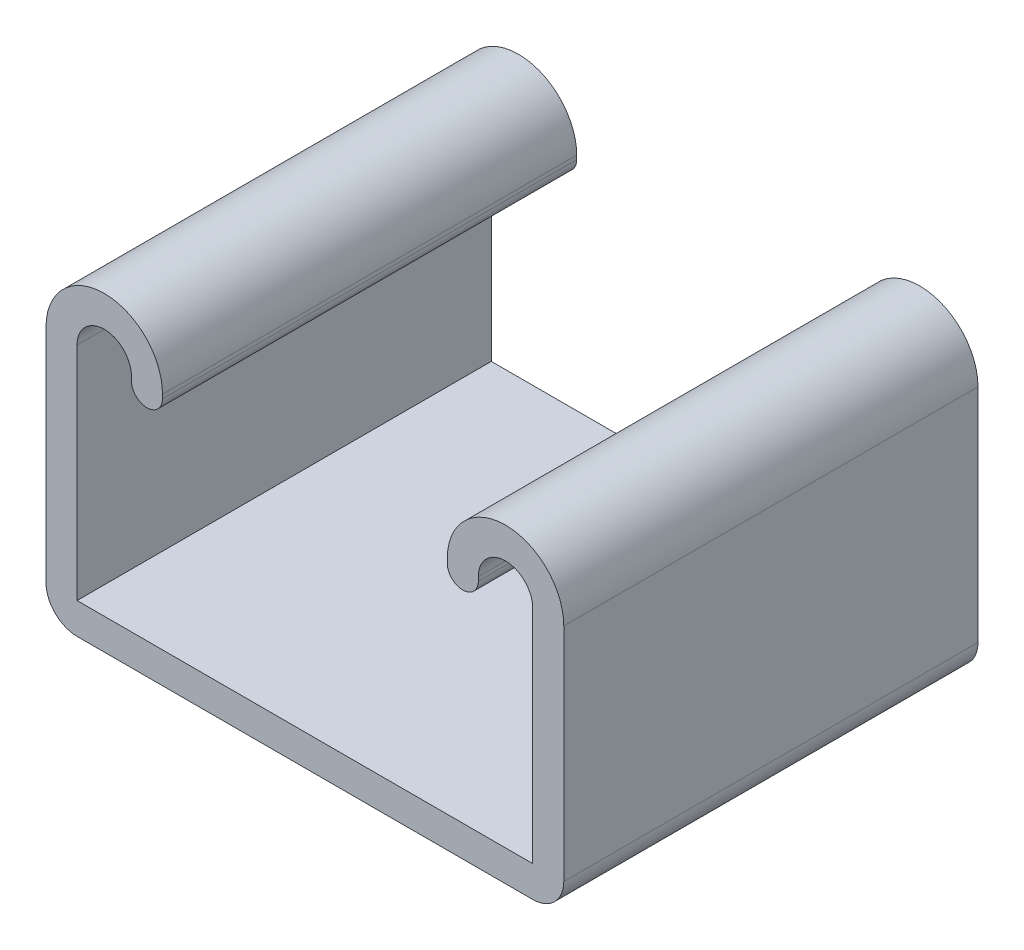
SolidWorks part; units mm, degrees
ref_plane "Plane1" through (0, 0, 0) normal (0, 0, 1) x (1, 0, 0)
ref_plane "Plane2" through (0, 0, 0) normal (0, 1, 0) x (1, 0, 0)
ref_plane "Plane3" through (0, 0, 0) normal (1, 0, 0) x (0, 0, -1)
sketch "Sketch1" plane through (0, 0, 0) normal (0, 0, 1) x (1, 0, 0)
  line L0 (-15.875, 7.6041) -> (-15.875, -5.969)
  line L1 (-13.97, -7.874) -> (13.97, -7.874)
  line L2 (15.875, -5.969) -> (15.875, 7.6041)
  line L3 (8.7312, 7.6041) -> (8.7312, 7.366)
  line L4 (-8.7312, 7.6041) -> (-8.7312, 7.366)
  line L5 (-10.6362, 7.6041) -> (-10.6363, 7.366)
  line L6 (-13.97, 7.6041) -> (-13.97, -5.969)
  line L7 (-13.97, -5.969) -> (13.97, -5.969)
  line L8 (13.97, -5.969) -> (13.97, 7.6041)
  line L9 (10.6363, 7.6041) -> (10.6363, 7.366)
  line L10 (-25.4, 11.176) -> (25.4, 11.176) construction
  line L11 (-12.8524, 6.4135) -> (12.8524, 6.4135) construction
  arc A0 (15.875, 7.6041) -> (8.7312, 7.6041) centre (12.3031, 7.6041) ccw
  arc A1 (-15.875, 7.6041) -> (-8.7312, 7.6041) centre (-12.3031, 7.6041) cw
  arc A2 (-13.97, -7.874) -> (-15.875, -5.969) centre (-13.97, -5.969) cw
  arc A3 (13.97, -7.874) -> (15.875, -5.969) centre (13.97, -5.969) ccw
  arc A4 (-13.97, 7.6041) -> (-10.6362, 7.6041) centre (-12.3031, 7.6041) cw
  arc A5 (13.97, 7.6041) -> (10.6363, 7.6041) centre (12.3031, 7.6041) ccw
  arc A6 (8.7312, 7.366) -> (10.6363, 7.366) centre (9.6837, 7.366) ccw
  arc A7 (-8.7312, 7.366) -> (-10.6363, 7.366) centre (-9.6837, 7.366) cw
  dimension "D1" = 1.905
  dimension "D3" = 15.875
  dimension "Width" = 31.75
  dimension "D5" = 7.874
  dimension "D6" = 7.1437
  dimension "D7" = 17.4625
  dimension "D8" = 11.176
  dimension "D9" = 4.7625
  dimension "gauge" = 1.905
extrude "Base-Extrude" add sketch "Sketch1" along normal mid plane 25.4
equation "\"D3@Sketch1\" = \"Width@Sketch1\" / 2"
equation "\"D7@Sketch1\" = \"Width@Sketch1\" - 2 * \"D6@Sketch1\""
equation "\"D1@Sketch1\" = \"gauge@Sketch1\""
